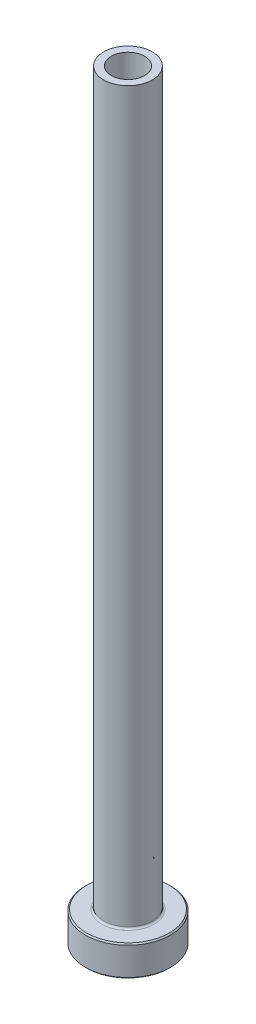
SolidWorks part; units mm, degrees
ref_plane "Front Plane" through (0, 0, 0) normal (0, 0, 1) x (1, 0, 0)
ref_plane "Top Plane" through (0, 0, 0) normal (0, 1, 0) x (1, 0, 0)
ref_plane "Right Plane" through (0, 0, 0) normal (1, 0, 0) x (0, 0, -1)
sketch "Sketch1" plane through (0, 0, 0) normal (0, 0, 1) x (1, 0, 0)
  line L0 (-2.75, 125) -> (-4, 125)
  line L1 (-4, 125) -> (-4, 5)
  line L2 (-4, 5) -> (-7, 5)
  line L3 (-7, 5) -> (-7, 0)
  line L4 (7.7, 0) -> (-7.7, 0) construction
  line L5 (-7, 0) -> (-3, 0)
  line L6 (-2.75, 80) -> (-2.75, 125)
  line L7 (0, 92.1877) -> (0, -15.5353) construction
  line L8 (0, -7.7) -> (0, 7.7) construction
  line L9 (-2.75, 80) -> (-3, 68)
  line L10 (-3, 68) -> (-3, 0)
  dimension "D1" = 0.25
  dimension "ID" = 5.5
  dimension "OD" = 8
  dimension "L" = 125
  dimension "H" = 14
  dimension "T" = 5
  dimension "N" = 45
  dimension "D2" = 12
revolve "Revolve1" add sketch "Sketch1" angle 360 about L7
fillet "Fillet1" radius 0.3 1 edges at (0, 5, 4)
chamfer "Chamfer1" distance 0.2 angle 45 2 edges at (0, 5, 7) (0, 0, 7)
chamfer "Chamfer3" distance 0.5 angle 45 1 edges at (0, 0, 3)
